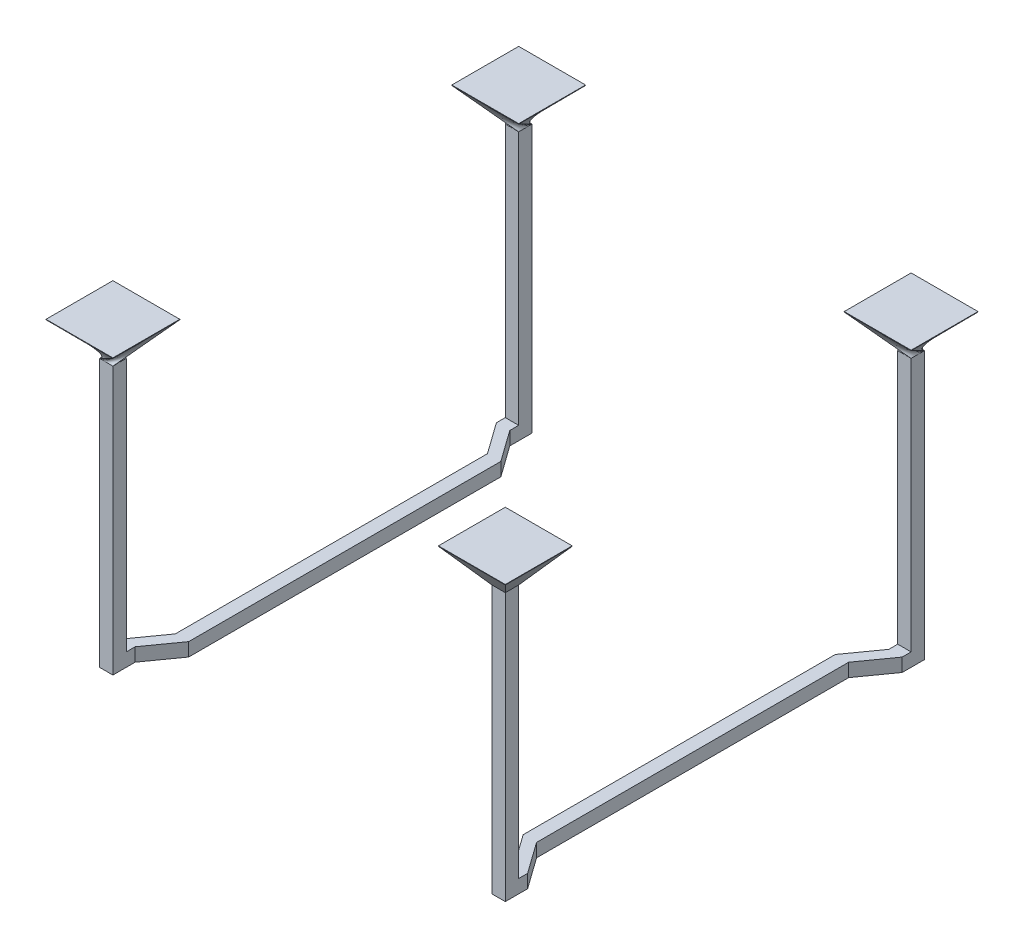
SolidWorks part; units mm, degrees
ref_plane "Front Plane" through (0, 0, 0) normal (0, 0, 1) x (1, 0, 0)
ref_plane "Top Plane" through (0, 0, 0) normal (0, 1, 0) x (1, 0, 0)
ref_plane "Right Plane" through (0, 0, 0) normal (1, 0, 0) x (0, 0, -1)
sketch "Sketch1" plane through (0, 0, 0) normal (0, 1, 0) x (1, 0, 0)
  line L0 (-12.3263, -145.6319) -> (-25.0263, -163.4119)
  line L1 (-25.0263, 49.9481) -> (-25.0263, 62.6481)
  line L2 (-12.3263, 32.1681) -> (-12.3263, -145.6319)
  line L3 (-25.0263, 62.6481) -> (-17.4063, 62.6481)
  line L4 (-4.7063, 32.1681) -> (-4.7063, -145.6319)
  line L6 (185.7937, 32.1681) -> (185.7937, -145.6319)
  line L8 (193.4137, 32.1681) -> (193.4137, -145.6319)
  line L10 (-17.4063, -163.4119) -> (-4.7063, -145.6319)
  line L11 (-12.3263, 32.1681) -> (-25.0263, 49.9481)
  line L13 (-17.4063, 49.9481) -> (-4.7063, 32.1681)
  line L14 (-25.0263, -163.4119) -> (-25.0263, -176.1119)
  line L15 (-25.0263, -176.1119) -> (-17.4063, -176.1119)
  line L16 (-17.4063, -176.1119) -> (-17.4063, -163.4119)
  line L19 (-17.4063, 62.6481) -> (-17.4063, 49.9481)
  line L20 (185.7937, -145.6319) -> (198.4937, -163.4119)
  line L21 (193.4137, -145.6319) -> (206.1137, -163.4119)
  line L22 (206.1137, -163.4119) -> (206.1137, -176.1119)
  line L23 (206.1137, -176.1119) -> (198.4937, -176.1119)
  line L24 (198.4937, -176.1119) -> (198.4937, -163.4119)
  line L25 (193.4137, 32.1681) -> (206.1137, 49.9481)
  line L27 (198.4937, 49.9481) -> (185.7937, 32.1681)
  line L28 (198.4937, 49.9481) -> (198.4937, 62.6481)
  line L29 (198.4937, 62.6481) -> (206.1137, 62.6481)
  line L30 (206.1137, 62.6481) -> (206.1137, 49.9481)
  dimension "D6" = 7.62
  dimension "D1" = 177.8
  dimension "D2" = 177.8
  dimension "D3" = 7.62
  dimension "D4" = 7.62
  dimension "D5" = 190.5
  dimension "D7" = 7.62
  dimension "D8" = 12.7
  dimension "D9" = 17.78
  dimension "D10" = 17.78
  dimension "D11" = 17.78
  dimension "D12" = 7.62
  dimension "D13" = 12.7
  dimension "D14" = 7.62
  dimension "D15" = 12.7
  dimension "D16" = 12.7
  dimension "D17" = 17.78
  dimension "D18" = 12.7
  dimension "D19" = 12.7
  dimension "D20" = 12.7
  dimension "D21" = 12.7
  dimension "D22" = 7.62
extrude "Boss-Extrude1" add sketch "Sketch1" along normal blind 152.4
sketch "Sketch2" plane through (193.4137, 0, 0) normal (1, 0, 0) x (0, 0, -1)
  line L0 (-176.1119, 152.4) -> (-176.1119, 0) construction
  line L1 (-168.4919, 192.9048) -> (55.0281, 192.9048)
  line L2 (-168.4919, 192.9048) -> (-168.4919, 7.62)
  line L3 (-168.4919, 7.62) -> (55.0281, 7.62)
  line L4 (55.0281, 192.9048) -> (55.0281, 7.62)
  line L5 (62.6481, 152.4) -> (62.6481, 0) construction
  line L7 (-145.6319, 0) -> (32.1681, 0) construction
  dimension "D1" = 7.62
  dimension "D2" = 7.62
  dimension "D4" = 7.62
extrude "Cut-Extrude3" cut sketch "Sketch2" against normal through all both and the other way through all
ref_plane "Plane1" through (0, 171.45, 0) normal (0, 1, 0) x (1, 0, 0)
sketch "Sketch5" plane through (0, 171.45, 0) normal (0, 1, 0) x (1, 0, 0)
  line L1 (-40.2663, 77.8881) -> (-2.1663, 77.8881)
  line L2 (-40.2663, 77.8881) -> (-40.2663, 39.7881)
  line L3 (-40.2663, 39.7881) -> (-2.1663, 39.7881)
  line L4 (-2.1663, 77.8881) -> (-2.1663, 39.7881)
  line L5 (-40.2663, 77.8881) -> (-2.1663, 39.7881) construction
  line L6 (-40.2663, 39.7881) -> (-2.1663, 77.8881) construction
  point P0 (-21.2163, 58.8381)
  dimension "D1" = 38.1
  dimension "D2" = 38.1
extrude "Boss-Extrude3" add sketch "Sketch5" along normal blind 0.254 separate body
sketch "Sketch6" plane through (11.8369, 171.45, 1.7346) normal (0, 1, 0) x (1, 0, 0)
  line L1 (-52.1032, -151.5172) -> (-14.0032, -151.5172)
  line L2 (-52.1032, -151.5172) -> (-52.1032, -189.6172)
  line L3 (-52.1032, -189.6172) -> (-14.0032, -189.6172)
  line L4 (-14.0032, -151.5172) -> (-14.0032, -189.6172)
  line L5 (-52.1032, -151.5172) -> (-14.0032, -189.6172) construction
  line L6 (-52.1032, -189.6172) -> (-14.0032, -151.5172) construction
  point P0 (-33.0532, -170.5672)
  dimension "D1" = 38.1
  dimension "D2" = 38.1
extrude "Boss-Extrude4" add sketch "Sketch6" along normal blind 0.254 separate body
sketch "Sketch7" plane through (0, 171.45, 0) normal (0, 1, 0) x (1, 0, 0)
  line L1 (183.2537, -153.2519) -> (221.3537, -153.2519)
  line L2 (183.2537, -153.2519) -> (183.2537, -191.3519)
  line L3 (183.2537, -191.3519) -> (221.3537, -191.3519)
  line L4 (221.3537, -153.2519) -> (221.3537, -191.3519)
  line L5 (183.2537, -153.2519) -> (221.3537, -191.3519) construction
  line L6 (183.2537, -191.3519) -> (221.3537, -153.2519) construction
  point P0 (202.3037, -172.3019)
  dimension "D1" = 38.1
  dimension "D2" = 38.1
extrude "Boss-Extrude5" add sketch "Sketch7" along normal blind 0.254 separate body
sketch "Sketch9" plane through (0, 171.45, 0) normal (0, 1, 0) x (1, 0, 0)
  line L1 (183.2537, 77.8881) -> (221.3537, 77.8881)
  line L2 (183.2537, 77.8881) -> (183.2537, 39.7881)
  line L3 (183.2537, 39.7881) -> (221.3537, 39.7881)
  line L4 (221.3537, 77.8881) -> (221.3537, 39.7881)
  line L5 (183.2537, 77.8881) -> (221.3537, 39.7881) construction
  line L6 (183.2537, 39.7881) -> (221.3537, 77.8881) construction
  point P0 (202.3037, 58.8381)
  dimension "D1" = 38.1
  dimension "D2" = 38.1
extrude "Boss-Extrude6" add sketch "Sketch9" along normal blind 0.254 separate body
loft "Loft8" add
loft "Loft9" add
loft "Loft11" add
loft "Loft12" add
